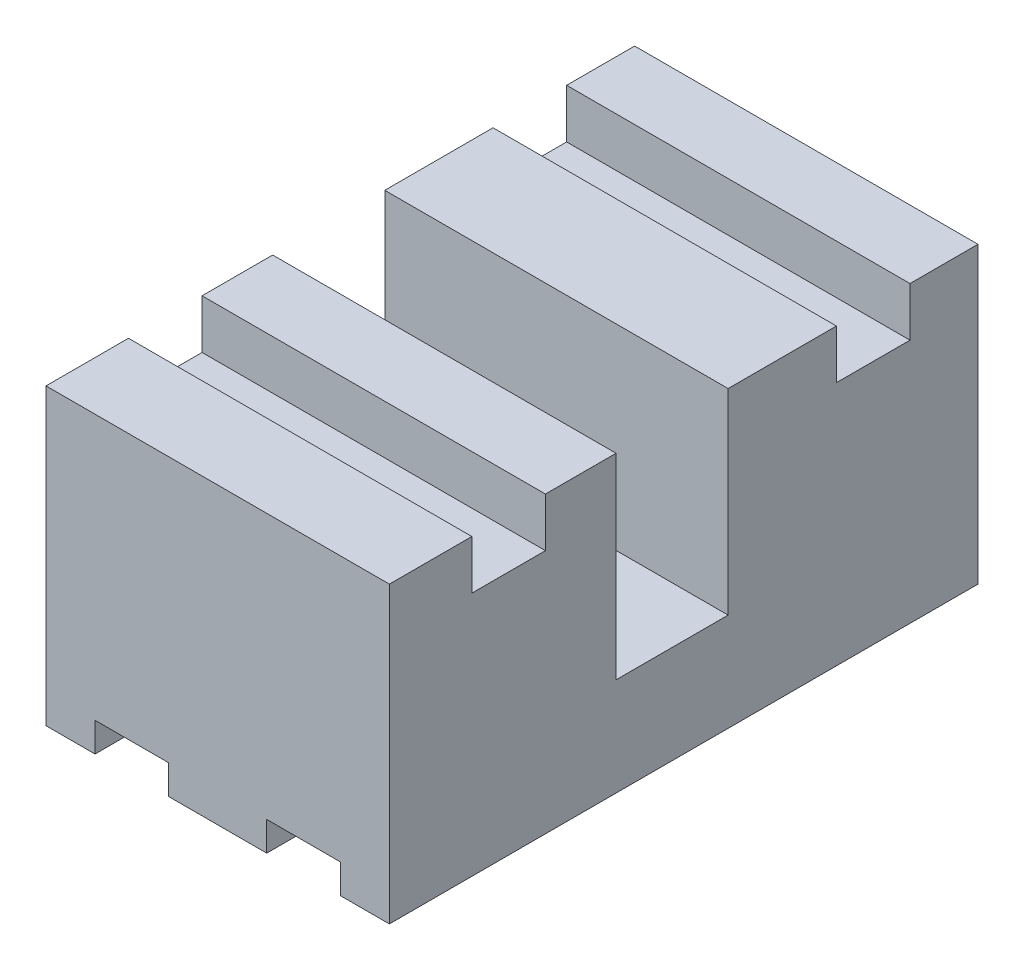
SolidWorks part; units mm, degrees
ref_plane "Front Plane" through (0, 0, 0) normal (0, 0, 1) x (1, 0, 0)
ref_plane "Top Plane" through (0, 0, 0) normal (0, 1, 0) x (1, 0, 0)
ref_plane "Right Plane" through (0, 0, 0) normal (1, 0, 0) x (0, 0, -1)
sketch "Sketch1" plane through (0, 0, 0) normal (0, 0, 1) x (1, 0, 0)
  line L0 (0, 50) -> (0, 0)
  line L1 (0, 0) -> (25, 0)
  line L2 (25, 0) -> (25, 14.8994)
  line L3 (25, 14.8994) -> (62.5, 14.8994)
  line L4 (62.5, 14.8994) -> (62.5, 0)
  line L5 (62.5, 0) -> (112.5, 0)
  line L6 (112.5, 0) -> (112.5, 14.8994)
  line L7 (112.5, 14.8994) -> (150, 14.8994)
  line L8 (150, 14.8994) -> (150, 0)
  line L9 (150, 0) -> (175, 0)
  line L10 (175, 0) -> (175, 50)
  line L11 (175, 50) -> (0, 50)
  dimension "D1" = 50
  dimension "D2" = 175
  dimension "D3" = 25
  dimension "D4" = 14.8994
  dimension "A" = 37.5
extrude "Boss-Extrude1" add sketch "Sketch1" along normal blind 300
sketch "Sketch2" plane through (0, 0, 0) normal (-1, 0, 0) x (0, 0, 1)
  line L0 (0, 50) -> (0, 150)
  line L1 (0, 150) -> (34.6566, 150)
  line L2 (34.6566, 150) -> (34.6566, 125)
  line L3 (34.6566, 125) -> (72.1566, 125)
  line L4 (72.1566, 125) -> (72.1566, 150)
  line L5 (72.1566, 150) -> (127.3527, 150)
  line L6 (127.3527, 150) -> (127.3527, 50)
  line L7 (300, 50) -> (0, 50) construction
  line L8 (127.3527, 50) -> (0, 50)
  line L10 (300, 50) -> (300, 150)
  line L11 (300, 150) -> (257.9659, 150)
  line L12 (257.9659, 150) -> (257.9659, 125)
  line L13 (257.9659, 125) -> (220.4659, 125)
  line L14 (220.4659, 125) -> (220.4659, 150)
  line L15 (220.4659, 150) -> (184.4717, 150)
  line L16 (184.4717, 150) -> (184.4717, 50)
  line L17 (184.4717, 50) -> (300, 50)
  dimension "D1" = 100
  dimension "D2" = 25
  dimension "D3" = 57.1191
extrude "Boss-Extrude2" add sketch "Sketch2" against normal up to vertex (175 mm away)
